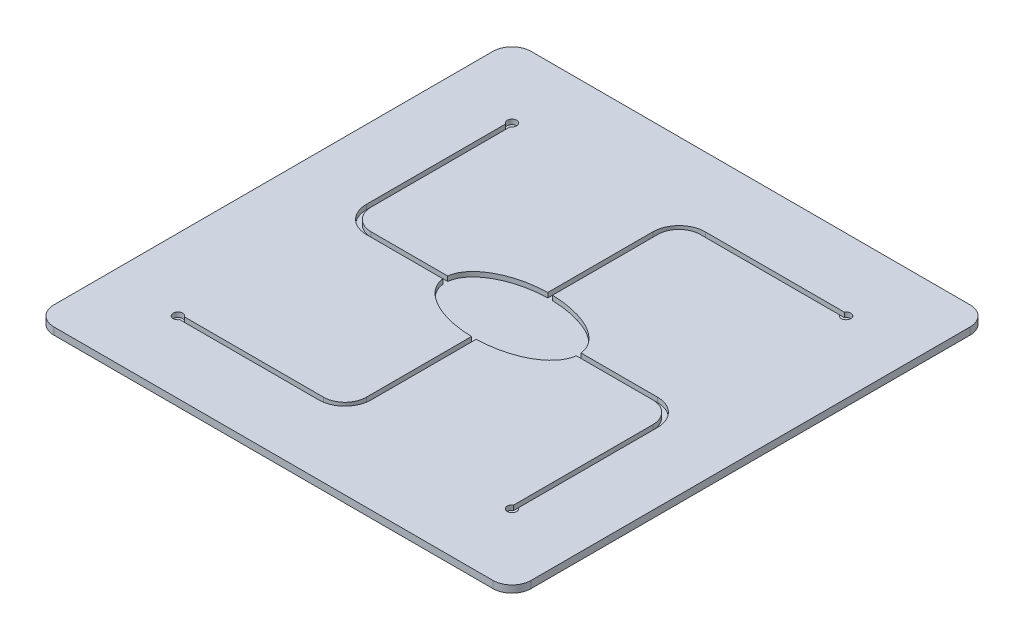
SolidWorks part; units mm, degrees
ref_plane "前视基准面" through (0, 0, 0) normal (0, 0, 1) x (1, 0, 0)
ref_plane "上视基准面" through (0, 0, 0) normal (0, 1, 0) x (1, 0, 0)
ref_plane "右视基准面" through (0, 0, 0) normal (1, 0, 0) x (0, 0, -1)
other "Configuration Table"
sketch "草图1" plane through (0, 0, 0) normal (0, 1, 0) x (1, 0, 0)
  line L1 (46, -50) -> (-46, -50)
  line L2 (50, -46) -> (50, 46)
  line L3 (46, 50) -> (-46, 50)
  line L4 (-50, -46) -> (-50, 46)
  line L5 (50, -50) -> (-50, 50) construction
  line L6 (50, 50) -> (-50, -50) construction
  arc A0 (-46, -50) -> (-50, -46) centre (-46, -46) cw
  arc A1 (46, -50) -> (50, -46) centre (46, -46) ccw
  arc A2 (46, 50) -> (50, 46) centre (46, 46) cw
  arc A3 (-50, 46) -> (-46, 50) centre (-46, 46) cw
  point P0 (0, 0)
  dimension "D3" = 4
  dimension "D1" = 100
  dimension "D2" = 100
extrude "凸台-拉伸1" add sketch "草图1" along normal blind 1.5
sketch "草图2" plane through (0, 1.5, 0) normal (0, 1, 0) x (1, 0, 0)
  line L0 (0, 8) -> (0, -8) construction
  line L1 (-14, 0) -> (14, 0) construction
  ellipse E0 centre (0, 0) end of major axis (-14, 0) minor radius 8
sketch "草图4" plane through (0, 1.5, 0) normal (0, 1, 0) x (1, 0, 0)
  line L0 (46, 50) -> (-46, 50) construction
  line L1 (-50, 46) -> (-50, -46) construction
  line L2 (-14, 0) -> (-30, 0)
  line L3 (-35, 5) -> (-35, 35)
  line L4 (5, 35) -> (35, 35)
  line L5 (0, 14) -> (0, 30)
  line L6 (35, -5) -> (35, -35)
  line L7 (14, 0) -> (30, 0)
  line L8 (-5, -35) -> (-35, -35)
  line L9 (0, -14) -> (0, -30)
  line L10 (0, 8) -> (0, 14)
  line L11 (-14, 0) -> (14, 0)
  line L12 (0, -8) -> (0, -14)
  line L13 (0, 8) -> (0, -8)
  arc A0 (-30, 0) -> (-35, 5) centre (-30, 5) cw
  arc A1 (0, 30) -> (5, 35) centre (5, 30) cw
  arc A2 (30, 0) -> (35, -5) centre (30, -5) cw
  arc A3 (0, -30) -> (-5, -35) centre (-5, -30) cw
  circle A4 centre (-35, 35) radius 1
  circle A5 centre (35, 35) radius 1
  circle A6 centre (35, -35) radius 1
  circle A7 centre (-35, -35) radius 1
  point P0 (-35, 35)
  point P30 (0, 0)
  point P38 (0, 0)
  dimension "D3" = 5
  dimension "D5" = 4
  dimension "D1" = 15
  dimension "D2" = 15
  dimension "D4" = 4
extrude "切除-拉伸-薄壁2" cut sketch "草图4" against normal blind 1 thin
extrude "切除-拉伸1" cut sketch "草图2" against normal blind 1 contours E0
sketch "草图5" plane through (0, 1.5, 0) normal (0, 1, 0) x (1, 0, 0)
  line L0 (-35.5, 35) -> (-34.5, 35) construction
  circle A0 centre (-35, 35) radius 1
  circle A1 centre (35, 35) radius 1
  circle A2 centre (35, -35) radius 1
  circle A3 centre (-35, -35) radius 1
  point P13 (0, 0)
  dimension "D1" = 4
extrude "切除-拉伸2" cut sketch "草图5" against normal blind 1
